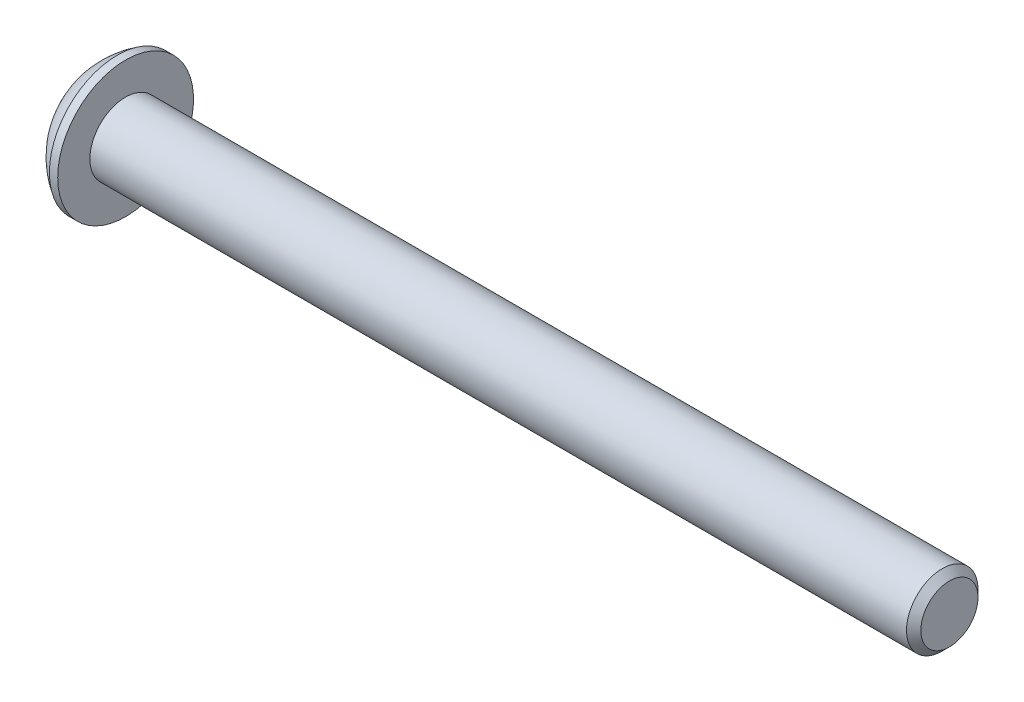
SolidWorks part; units mm, degrees
ref_plane "Plan de face" through (0, 0, 0) normal (0, 0, 1) x (1, 0, 0)
ref_plane "Plan de dessus" through (0, 0, 0) normal (0, 1, 0) x (1, 0, 0)
ref_plane "Plan de droite" through (0, 0, 0) normal (1, 0, 0) x (0, 0, -1)
sketch "Esquisse1" plane through (0, 0, 0) normal (0, 0, 1) x (1, 0, 0)
  line L0 (-65.3427, 0) -> (101.7319, 0) construction
  line L1 (93.1668, 0) -> (93.1668, 1.2)
  line L2 (93.1668, 1.2) -> (92.8668, 1.5)
  line L3 (92.8668, 1.5) -> (58.5868, 1.5)
  line L4 (58.5868, 1.5) -> (58.5868, 2.85)
  line L5 (58.5868, 2.85) -> (58.2368, 2.85)
  line L6 (56.9368, 1.425) -> (56.9368, 0)
  line L7 (58.2368, 2.85) -> (58.2368, 0)
  arc A0 (58.2368, 2.85) -> (56.9368, 1.425) centre (59.9569, -0.0247) ccw
  point P11 (58.5868, 2.175)
  dimension "D6" = 3.35
  dimension "D1" = 1.5
  dimension "D2" = 34.28
  dimension "D3" = 0.35
  dimension "D4" = 0.3
  dimension "D5" = 45
  dimension "D7" = 1.425
  dimension "D8" = 1.65
  dimension "D9" = 2.85
revolve "Révolution1" add sketch "Esquisse1" angle 360 about L0
sketch "Esquisse2" plane through (56.9368, 0, 0) normal (-1, 0, 0) x (0, 0, 1)
  line L1 (-1, -0.5774) -> (0, -1.1547)
  line L2 (0, -1.1547) -> (1, -0.5774)
  line L3 (1, -0.5774) -> (1, 0.5774)
  line L4 (1, 0.5774) -> (0, 1.1547)
  line L5 (0, 1.1547) -> (-1, 0.5774)
  line L6 (-1, 0.5774) -> (-1, -0.5774)
  circle A0 centre (0, 0) radius 1.1547 construction
  dimension "D1" = 2
extrude "Enlèv. mat.-Extru.3" cut sketch "Esquisse2" against normal blind 1
